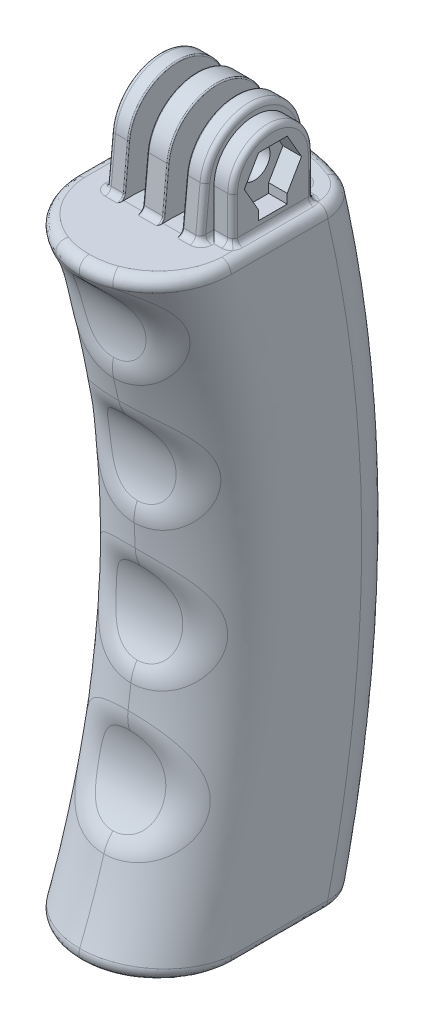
SolidWorks part; units mm, degrees
ref_plane "Front Plane" through (0, 0, 0) normal (0, 0, 1) x (1, 0, 0)
ref_plane "Top Plane" through (0, 0, 0) normal (0, 1, 0) x (1, 0, 0)
ref_plane "Right Plane" through (0, 0, 0) normal (1, 0, 0) x (0, 0, -1)
ref_plane "Plane1" through (0, -98.425, 0) normal (0, 1, 0) x (1, 0, 0)
sketch "Sketch1" plane through (0, -98.425, 0) normal (0, 1, 0) x (1, 0, 0)
  line L0 (-12.7, 0) -> (-12.7, 19.05)
  line L1 (12.7, 0) -> (12.7, 19.05)
  arc A0 (12.7, 0) -> (-12.7, 0) centre (0, 0) cw
  arc A1 (-12.7, 19.05) -> (12.7, 19.05) centre (0, 0) cw
  dimension "D1" = 25.4
  dimension "D2" = 19.05
sketch "Sketch3" plane through (0, 0, 0) normal (0, 1, 0) x (1, 0, 0)
  line L0 (-12.7, 0) -> (-12.7, 19.05)
  line L1 (12.7, 0) -> (12.7, 19.05)
  arc A0 (12.7, 0) -> (-12.7, 0) centre (0, 0) cw
  arc A1 (-12.7, 19.05) -> (12.7, 19.05) centre (0, 0) cw
  dimension "D1" = 25.4
  dimension "D2" = 19.05
sketch "Sketch4" plane through (0, 0, 0) normal (1, 0, 0) x (0, 0, -1)
  line L0 (22.8953, 0) -> (19.05, 0) construction
  line L1 (22.8953, 0) -> (19.05, 0) construction
  line L2 (22.8953, -98.425) -> (19.05, -98.425) construction
  line L3 (22.8953, -98.425) -> (19.05, -98.425) construction
  arc A0 (22.8953, 0) -> (22.8953, -98.425) centre (-200.3447, -49.2125) cw
  dimension "D1" = 228.6
sketch "Sketch5" plane through (0, 0, 0) normal (1, 0, 0) x (0, 0, -1)
  line L0 (0, -98.425) -> (-12.7, -98.425) construction
  line L1 (0, 0) -> (-12.7, 0) construction
  line L2 (0, -98.425) -> (-12.7, -98.425) construction
  line L3 (0, 0) -> (-12.7, 0) construction
  arc A0 (-12.7, -98.425) -> (-12.7, 0) centre (-129.7775, -49.2125) ccw
  dimension "D1" = 127
loft "Loft1" add profiles "Sketch1", "Sketch3"
sketch "Sketch6" plane through (0, 0, 0) normal (1, 0, 0) x (0, 0, -1)
  line L0 (-18.7569, -13.5381) -> (-6.6659, -9.6525) construction
  line L1 (0, 0) -> (-12.7, 0) construction
  line L2 (-14.25, -33.3509) -> (-1.668, -31.6239) construction
  line L3 (-13.2513, -53.6596) -> (-0.5606, -54.1437) construction
  line L4 (-15.7934, -73.8268) -> (-3.3795, -76.5073) construction
  arc A0 (-11.4155, -3.175) -> (-6.7528, -17.6842) centre (-18.7569, -13.5381) cw
  arc A1 (-12.7, 0) -> (-12.7, -98.425) centre (-9873.3511, -49.2125) cw construction
  arc A2 (-5.2205, -24.4201) -> (-3.1482, -39.5185) centre (-14.25, -33.3509) cw
  arc A3 (-2.8082, -46.4324) -> (-3.3892, -61.6613) centre (-13.2513, -53.6596) cw
  arc A4 (-4.2539, -68.5229) -> (-7.4705, -83.4195) centre (-15.7934, -73.8268) cw
  spline S1 degree 3 poles (-1483.8254, 1163.1679) (490.9056, -2079.5732) (490.9047, 1981.1504) (-1483.8281, -1261.5972) knots -5.608732 -5.608732 -5.608732 -5.608732 6.608737 6.608737 6.608737 6.608737 only from (-12.7, -98.425) to (-12.7, 0) construction
  spline S3 degree 3 poles (-12.7, -98.425) (0.5296, -66.9516) (0.5296, -31.4734) (-12.7, 0) knots 0 0 0 0 1 1 1 1
extrude "Cut-Extrude1" cut sketch "Sketch6" against normal through all both and the other way through all contours S3 A0 | S3 A2 | S3 A3 | S3 A4
fillet "Fillet1" radius 6.35 2 edges
fillet "Fillet2" radius 6.35 8 edges at (7.6735, -76.3636, 3.3493) (-7.6731, -76.6172, 3.4037) (7.7202, -54.0407, 0.557) (-7.7202, -54.2403, 0.5646) (7.7014, -31.5243, 1.682) (-7.7016, -31.7458, 1.6518) (7.621, -9.5214, 6.7088) (-7.6217, -9.8303, 6.6102)
fillet "Fillet3" radius 1.5875 14 edges at (-11.2409, -98.425, -19.278) (11.8554, -98.425, -18.3683) (-11.8554, 0, -18.3683) (11.2409, 0, -19.278)
sketch "Sketch7" plane through (0, 0, 0) normal (1, 0, 0) x (0, 0, -1)
  line L0 (15.491, 0) -> (0, 0) construction
  line L1 (0, 0) -> (17.4625, 0)
  line L2 (0.7687, 7.9169) -> (8.7313, 7.1437) construction
  line L3 (0.7687, 7.9169) -> (0, 0)
  line L4 (16.6938, 7.9169) -> (17.4625, 0)
  line L5 (8.7313, 0) -> (8.7313, 7.1437) construction
  line L6 (4.75, 7.5303) -> (4.0188, 0) construction
  arc A0 (0.7687, 7.9169) -> (16.6938, 7.9169) centre (8.7313, 7.1437) cw
  circle A1 centre (8.7313, 7.1437) radius 2.54
extrude "Boss-Extrude1" add sketch "Sketch7" along normal mid plane 15.24
sketch "Sketch10" plane through (-7.62, 0, 0) normal (-1, 0, 0) x (0, 0, 1)
  line L0 (-14.1923, 7.1437) -> (-14.1923, 0)
  line L1 (0, 0) -> (-17.4625, 0) construction
  line L2 (-3.2703, 7.1437) -> (-3.2703, 0)
  line L3 (-14.1923, 0) -> (-3.2703, 0)
  arc A0 (-14.1923, 7.1437) -> (-3.2703, 7.1437) centre (-8.7313, 7.1437) cw
  circle A1 centre (-8.7313, 7.1437) radius 2.54 construction
  circle A2 centre (-8.7313, 7.1437) radius 2.54
extrude "Boss-Extrude2" [suppressed] add sketch "Sketch10" along normal blind 2.3813
sketch "Sketch11" plane through (7.62, 0, 0) normal (1, 0, 0) x (0, 0, -1)
  line L0 (2.2313, 7.1437) -> (2.2313, 0)
  line L1 (13.3501, 7.1437) -> (11.0407, 11.1438)
  line L2 (11.0407, 11.1438) -> (6.4218, 11.1438)
  line L3 (6.4218, 11.1438) -> (4.1124, 7.1438)
  line L4 (4.1124, 7.1438) -> (6.4218, 3.1437)
  line L5 (6.4218, 3.1437) -> (11.0407, 3.1437) construction
  line L6 (11.0407, 3.1437) -> (13.3501, 7.1437)
  line L7 (0, 0) -> (17.4625, 0) construction
  line L8 (2.2313, 0) -> (15.2312, 0)
  line L9 (15.2312, 0) -> (15.2312, 7.1437)
  line L10 (6.4218, 3.1437) -> (6.4218, 1.6437)
  line L11 (6.4218, 1.6437) -> (11.0407, 1.6437)
  line L12 (11.0407, 1.6437) -> (11.0407, 3.1437)
  circle A0 centre (8.7313, 7.1437) radius 4 construction
  arc A1 (2.2313, 7.1437) -> (15.2312, 7.1437) centre (8.7313, 7.1437) cw
extrude "Boss-Extrude3" add sketch "Sketch11" along normal blind 3
ref_plane "Plane2" through (0, 0, -8.7313) normal (0, 0, 1) x (1, 0, 0)
sketch "Sketch12" plane through (0, 0, -8.7313) normal (0, 0, 1) x (1, 0, 0)
  line L0 (7.62, 0) -> (-7.62, 0) construction
  line L1 (10.62, 7.1437) -> (10.62, 13.6437) construction
  line L2 (-4.699, 15.1438) -> (-1.651, 15.1438)
  line L3 (-4.699, 15.1438) -> (-4.699, 7.1437)
  line L5 (-1.651, 15.1438) -> (-1.651, 7.1437)
  line L6 (-1.651, 7.1437) -> (1.651, 7.1437) construction
  line L7 (1.651, 15.1438) -> (4.699, 15.1438)
  line L8 (1.651, 15.1438) -> (1.651, 7.1437)
  line L10 (4.699, 15.1438) -> (4.699, 7.1437)
  line L11 (7.62, 7.1437) -> (7.62, 0) construction
  line L13 (7.62, 7.9169) -> (7.62, 15.1438) construction
  line L15 (10.62, 7.1437) -> (10.62, 13.6437) construction
  line L16 (4.699, 7.1437) -> (1.651, 7.1437)
  line L17 (-1.651, 7.1437) -> (-4.699, 7.1437)
  line L18 (7.62, 7.9169) -> (7.62, 15.1438) construction
  line L19 (7.62, 4.6037) -> (7.62, 9.6838) construction
  line L20 (7.62, 4.6037) -> (7.62, 9.6838) construction
  point P4 (0, 0)
  point P18 (0, 7.1437)
  point P27 (7.62, 7.1437)
  dimension "D1" = 3.302
  dimension "D2" = 0
  dimension "D3" = 3.048
revolve "Cut-Revolve1" cut sketch "Sketch12" angle 360 about L6
fillet "Fillet7" radius 25.4 4 edges at (-3.175, 7.9169, -16.6938) (3.175, 7.9169, -16.6938) (3.175, 7.9169, -0.7687) (-3.175, 7.9169, -0.7687)
fillet "Fillet4" radius 0.7937 9 edges at (10.62, 3.5719, -15.2312) (10.62, 3.5719, -2.2313) (7.62, 3.9584, -17.0782) (7.62, 3.9584, -0.3843) (-7.62, 3.9584, -17.0782) (-7.62, 3.9584, -0.3843) (10.62, 13.6437, -8.7313) (7.62, 15.1438, -8.7313) (-7.62, 15.1438, -8.7313)
fillet "Fillet8" radius 1 18 edges at (8.7231, 0, -15.2312) (10.3875, 0, -14.9988) (10.62, 0, -8.7313) (10.3875, 0, -2.4637) (8.7231, 0, -2.2313) (7.62, 0, -1.5144) (7.3875, 0, -0.2336) (5.7626, 0, 0) (0, 0, 0) (-5.7626, 0, 0) (-7.3875, 0, -0.2336) (-7.62, 0, -8.7313) (-7.3875, 0, -17.2289) (-5.7626, 0, -17.4625) (0, 0, -17.4625) (5.7626, 0, -17.4625) (7.3875, 0, -17.2289) (7.62, 0, -15.9481)
fillet "Fillet9" radius 0.1984 20 edges at (4.699, 0.2595, 0.2355) (4.699, 4.4101, -0.4282) (4.699, 0.2595, -17.698) (4.699, 4.4101, -17.0343) (1.651, 0.2595, -17.698) (1.651, 4.4101, -17.0343) (1.651, 0.2595, 0.2355) (1.651, 4.4101, -0.4282) (-1.651, 0.2595, 0.2355) (-1.651, 4.4101, -0.4282) (-1.651, 0.2595, -17.698) (-1.651, 4.4101, -17.0343) (-4.699, 0.2595, -17.698) (-4.699, 4.4101, -17.0343) (-4.699, 0.2595, 0.2355) (-4.699, 4.4101, -0.4282) (4.699, 15.1438, -8.7313) (1.651, 15.1438, -8.7313) (-1.651, 15.1438, -8.7313) (-4.699, 15.1438, -8.7313)
equation "\"D5@Sketch6\"=\"D4@Sketch6\""
equation "\"D6@Sketch6\"=\"D4@Sketch6\""
equation "\"D1@Sketch7\"=16mm/2"
equation "\"D1@Sketch10\"=0.43/2"
equation "\"D1@Sketch11\"=8mm"
equation "\"D2@Sketch11\"=13mm"
equation "\"D3@Sketch11\"=1.5mm"
equation "\"D1@Boss-Extrude3\"=3mm"
